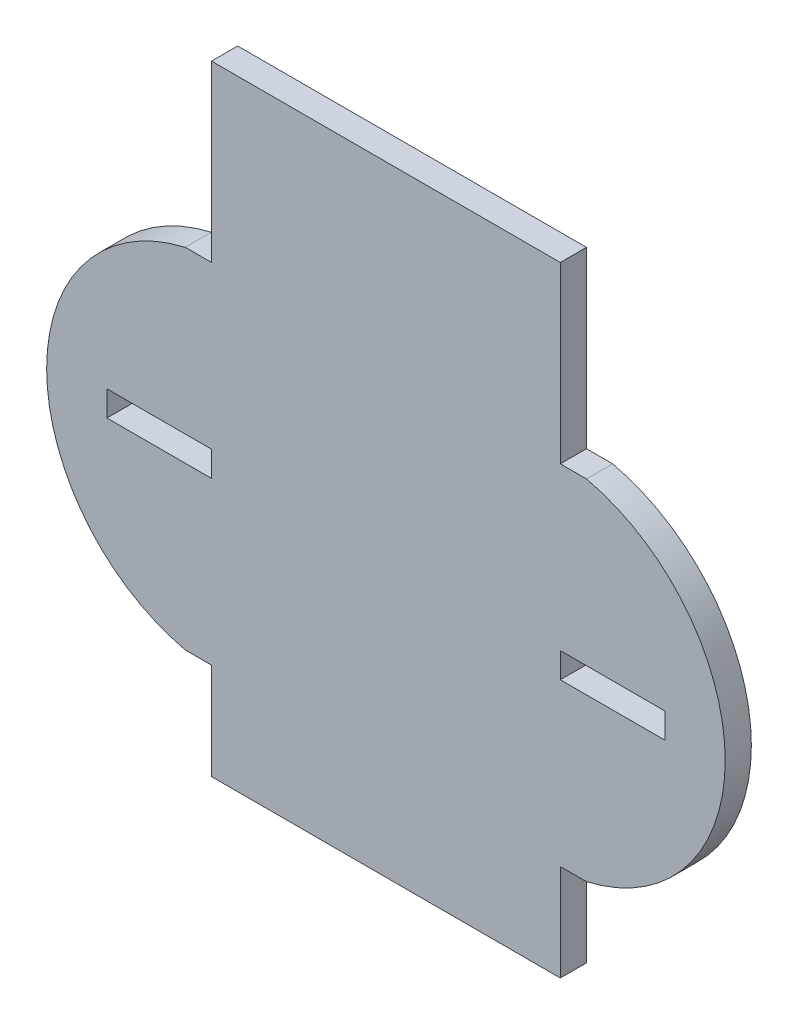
SolidWorks part; units mm, degrees
ref_plane "Plan de face" through (0, 0, 0) normal (0, 0, 1) x (1, 0, 0)
ref_plane "Plan de dessus" through (0, 0, 0) normal (0, 1, 0) x (1, 0, 0)
ref_plane "Plan de droite" through (0, 0, 0) normal (1, 0, 0) x (0, 0, -1)
sketch "Esquisse1" plane through (0, 0, 0) normal (0, 0, 1) x (1, 0, 0)
  line L0 (0, 0) -> (0, 17.7293) construction
  line L2 (-20, -31.0712) -> (-20, -20)
  line L3 (-20, 40) -> (20, 40)
  line L4 (20, -31.0712) -> (20, -20)
  line L5 (-20, -40) -> (20, 40) construction
  line L6 (-20, 40) -> (20, -40) construction
  line L7 (-23, -20) -> (-20, -20)
  line L9 (-23, 20) -> (-20, 20)
  line L11 (-23, -20) -> (-20, 0) construction
  line L12 (-23, 20) -> (-20, 0) construction
  line L13 (-20, 20) -> (-20, 40)
  line L14 (-23, 0) -> (-40.3574, 0) construction
  line L15 (23, -20) -> (20, -20)
  line L16 (23, 20) -> (20, 20)
  line L17 (20, 20) -> (20, 40)
  line L18 (20, 1.45) -> (20, -1.45)
  line L19 (-32, 1.45) -> (-20, 1.45)
  line L20 (-32, 1.45) -> (-32, -1.45)
  line L21 (-32, -1.45) -> (-20, -1.45)
  line L22 (-20, 1.45) -> (-20, -1.45)
  line L23 (-32, 1.45) -> (-20, -1.45) construction
  line L24 (-32, -1.45) -> (-20, 1.45) construction
  line L25 (32, 1.45) -> (32, -1.45)
  line L26 (32, -1.45) -> (20, -1.45)
  line L27 (32, 1.45) -> (20, 1.45)
  line L28 (-20, -31.0712) -> (20, -31.0712)
  arc A0 (-23, -20) -> (-23, 20) centre (-18.3874, 0) cw
  arc A1 (23, -20) -> (23, 20) centre (18.3874, 0) ccw
  point P0 (0, 0)
  point P6 (-20, 0)
  point P16 (-39, 0)
  point P23 (-26, 0)
  point P24 (-26, 0)
  dimension "D1" = 40
  dimension "D2" = 80
  dimension "D3" = 16
  dimension "D4" = 40
  dimension "D5" = 6
  dimension "D6" = 2.9
  dimension "D7" = 12
extrude "Boss.-Extru.1" add sketch "Esquisse1" along normal blind 3
